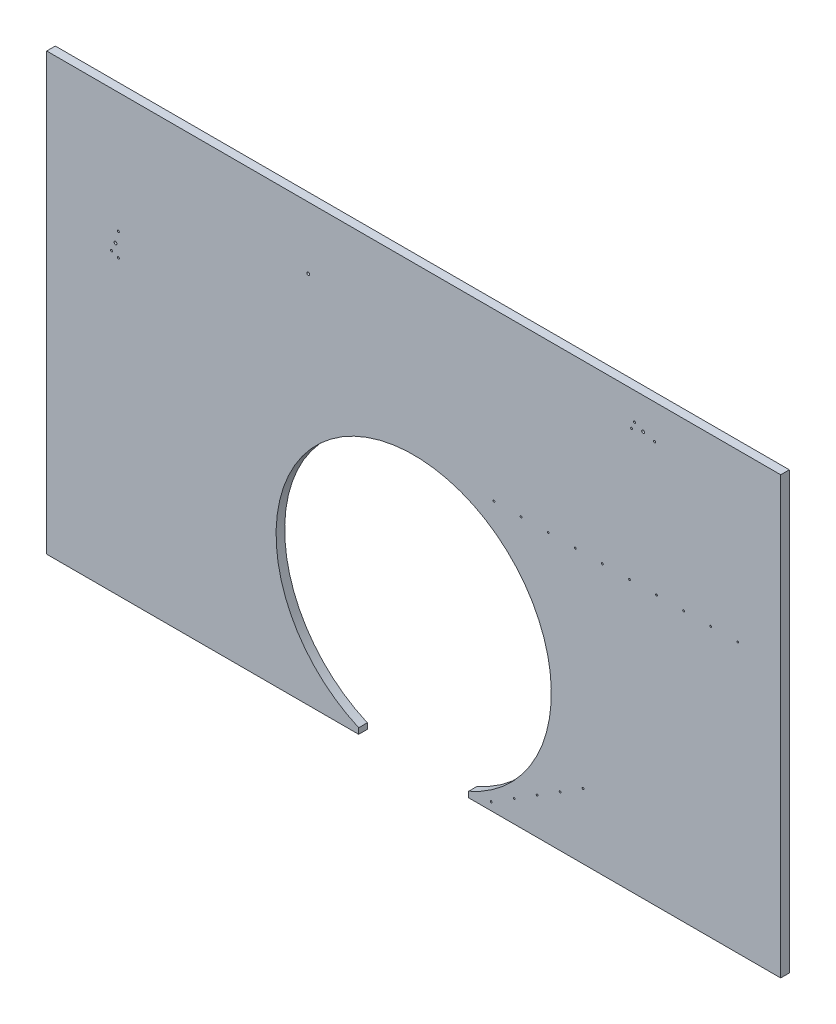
SolidWorks part; units mm, degrees
ref_plane "Front Plane" through (0, 0, 0) normal (0, 0, 1) x (1, 0, 0)
ref_plane "Top Plane" through (0, 0, 0) normal (0, 1, 0) x (1, 0, 0)
ref_plane "Right Plane" through (0, 0, 0) normal (1, 0, 0) x (0, 0, -1)
sketch "Sketch1" plane through (0, 0, 0) normal (0, 0, 1) x (1, 0, 0)
  line L1 (-812.8, 952.5) -> (812.8, 952.5)
  line L2 (-812.8, 952.5) -> (-812.8, -12.7)
  line L3 (-812.8, -12.7) -> (812.8, -12.7)
  line L4 (812.8, 952.5) -> (812.8, -12.7)
  dimension "D1" = 1625.6
  dimension "D2" = 965.2
  dimension "D3" = 12.7
  dimension "D4" = 812.8
extrude "Boss-Extrude1" add sketch "Sketch1" along normal blind 19.05
sketch "Sketch2" plane through (0, 0, 19.05) normal (0, 0, 1) x (1, 0, 0)
  line L0 (-121.8141, 0) -> (121.8141, 0)
  arc A0 (121.8141, 0) -> (-121.8141, 0) centre (0, 279.4) ccw
  dimension "D1" = 609.6
  dimension "D2" = 279.4
  dimension "D3" = 0
  dimension "D4" = 279.4
extrude "Cut-Extrude1" cut sketch "Sketch2" against normal through all
sketch "Sketch3" plane through (0, 0, 19.05) normal (0, 0, 1) x (1, 0, 0)
  circle A0 centre (508, 882.65) radius 3.175
  point P2 (0, 279.4)
  dimension "D3" = 6.35
  dimension "D1" = 603.25
  dimension "D2" = 508
extrude "Cut-Extrude2" cut sketch "Sketch3" against normal blind 12.7
sketch "Sketch6" plane through (0, 0, 19.05) normal (0, 0, 1) x (1, 0, 0)
  line L0 (121.8141, 0) -> (0, 279.4) construction
  line L1 (0, 279.4) -> (-233.4771, 814.9167) construction
  circle A0 centre (-233.4771, 814.9167) radius 3.175
  dimension "D2" = 6.35
  dimension "D1" = 584.2
extrude "Cut-Extrude5" cut sketch "Sketch6" against normal blind 12.7 contours A0
sketch "Sketch7" plane through (0, 0, 19.05) normal (0, 0, 1) x (1, 0, 0)
  circle A0 centre (-660.4, 660.4) radius 3.175
  point P2 (0, 279.4)
  dimension "D3" = 6.35
  dimension "D1" = 660.4
  dimension "D2" = 381
extrude "Cut-Extrude6" cut sketch "Sketch7" against normal blind 12.7
sketch "Sketch5" plane through (0, 0, 19.05) normal (0, 0, 1) x (1, 0, 0)
  line L0 (177.8, 584.2) -> (736.6, 584.2) construction
  arc A0 (121.8141, 0) -> (-121.8141, 0) centre (0, 279.4) ccw construction
  circle A1 centre (177.8, 584.2) radius 2
  circle A2 centre (237.8, 584.2) radius 2
  circle A3 centre (297.8, 584.2) radius 2
  circle A4 centre (357.8, 584.2) radius 2
  circle A5 centre (417.8, 584.2) radius 2
  circle A6 centre (477.8, 584.2) radius 2
  circle A7 centre (537.8, 584.2) radius 2
  circle A8 centre (597.8, 584.2) radius 2
  circle A9 centre (657.8, 584.2) radius 2
  circle A10 centre (717.8, 584.2) radius 2
  point P0 (177.8, 584.2)
  point P1 (736.6, 584.2)
  point P5 (0, 279.4)
  dimension "D5" = 4
  dimension "D1" = 304.8
  dimension "D2" = 177.8
  dimension "D3" = 736.6
  dimension "D4" = 304.8
  dimension "D6" = 10
sketch "Sketch4" plane through (0, 0, 19.05) normal (0, 0, 1) x (1, 0, 0)
  line L0 (0, 279.4) -> (249.4105, -119.7403) construction
  line L1 (249.4105, -119.7403) -> (0, 279.4) construction
  line L2 (0, 279.4) -> (0, -175.7054) construction
  line L3 (171.6144, 4.7596) -> (222.4972, 36.5548) construction
  line L4 (171.6144, 4.7596) -> (273.3801, 68.3499) construction
  line L5 (273.3801, 68.3499) -> (324.263, 100.1451) construction
  line L6 (324.263, 100.1451) -> (375.1459, 131.9402) construction
  circle A0 centre (171.6144, 4.7596) radius 2
  circle A1 centre (222.4972, 36.5548) radius 2
  circle A2 centre (273.3801, 68.3499) radius 2
  circle A3 centre (324.263, 100.1451) radius 2
  circle A4 centre (375.1459, 131.9402) radius 2
  point P0 (0, 279.4)
  dimension "D3" = 4
  dimension "D6" = 4
  dimension "D10" = 4
  dimension "D11" = 4
  dimension "D12" = 4
  dimension "D1" = 32
  dimension "D2" = 323.85
  dimension "D4" = 90
  dimension "D5" = 60
  dimension "D7" = 120
  dimension "D8" = 60
  dimension "D9" = 60
extrude "Cut-Extrude7" cut sketch "Sketch5" against normal through all
extrude "Cut-Extrude8" cut sketch "Sketch4" against normal through all
sketch "Sketch8" plane through (0, 0, 19.05) normal (0, 0, 1) x (1, 0, 0)
  line L0 (121.8141, 0) -> (0, 279.4) construction
  line L1 (0, 279.4) -> (-121.8141, 558.8) construction
  arc A0 (121.8141, 0) -> (-121.8141, 0) centre (0, 279.4) ccw construction
sketch "Sketch9" plane through (0, 0, 0) normal (0, 0, -1) x (-1, 0, 0)
  circle A0 centre (654.05, 685.8) radius 2.2479 construction
  circle A1 centre (654.05, 685.8) radius 2.2479
  circle A2 centre (669.29, 641.35) radius 2.2479 construction
  circle A3 centre (669.29, 641.35) radius 2.2479
  circle A4 centre (654.05, 635) radius 2.2479 construction
  circle A5 centre (654.05, 635) radius 2.2479
  circle A6 centre (-488.95, 891.54) radius 2.2479 construction
  circle A7 centre (-488.95, 891.54) radius 2.2479
  circle A8 centre (-482.6, 876.3) radius 2.2479 construction
  circle A9 centre (-482.6, 876.3) radius 2.2479
  circle A10 centre (-533.4, 876.3) radius 2.2479 construction
  circle A11 centre (-533.4, 876.3) radius 2.2479
extrude "Cut-Extrude9" cut sketch "Sketch9" against normal through all
sketch "Sketch10" plane through (0, 0, 19.05) normal (0, 0, 1) x (1, 0, 0)
  line L0 (-812.8, -12.7) -> (812.8, -12.7) construction
  line L1 (-121.8141, -12.7) -> (121.8141, -12.7)
  line L2 (-121.8141, -12.7) -> (-121.8141, 0)
  line L3 (-121.8141, 0) -> (121.8141, 0)
  line L4 (121.8141, -12.7) -> (121.8141, 0)
  line L5 (-121.8141, -12.7) -> (121.8141, 0) construction
  line L6 (-121.8141, 0) -> (121.8141, -12.7) construction
  point P0 (0, -6.35)
  dimension "D1" = 243.6282
extrude "Cut-Extrude10" cut sketch "Sketch10" against normal through all
